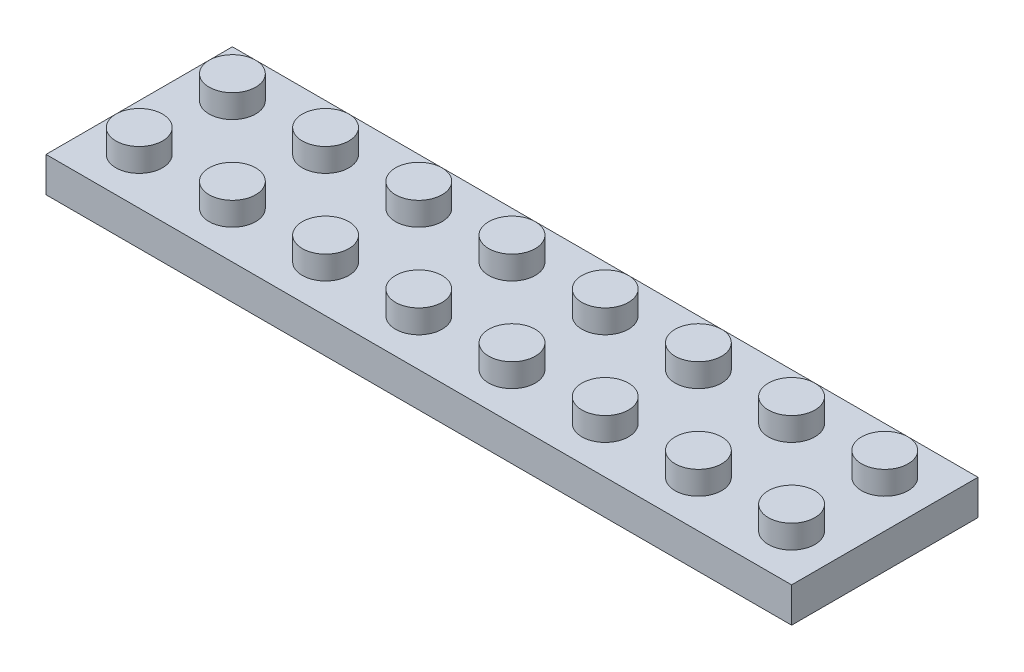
SolidWorks part; units mm, degrees
ref_plane "Front Plane" through (0, 0, 0) normal (0, 0, 1) x (1, 0, 0)
ref_plane "Top Plane" through (0, 0, 0) normal (0, 1, 0) x (1, 0, 0)
ref_plane "Right Plane" through (0, 0, 0) normal (1, 0, 0) x (0, 0, -1)
sketch "Croquis1" plane through (0, 0, 0) normal (0, 1, 0) x (1, 0, 0)
  line L1 (-32, 8) -> (32, 8)
  line L2 (-32, 8) -> (-32, -8)
  line L3 (-32, -8) -> (32, -8)
  line L4 (32, 8) -> (32, -8)
  line L5 (-32, 8) -> (32, -8) construction
  line L6 (-32, -8) -> (32, 8) construction
  point P0 (0, 0)
  dimension "D1" = 64
  dimension "D2" = 16
extrude "Saliente-Extruir1" add sketch "Croquis1" along normal blind 3
sketch "Croquis2" plane through (0, 3, 0) normal (0, 1, 0) x (1, 0, 0)
  line L0 (32, 8) -> (-32, 8) construction
  line L1 (-32, 8) -> (-32, -8) construction
  circle A0 centre (-28, 4) radius 2
  circle A1 centre (-20, 4) radius 2
  circle A2 centre (-12, 4) radius 2
  circle A3 centre (-4, 4) radius 2
  circle A4 centre (4, 4) radius 2
  circle A5 centre (12, 4) radius 2
  circle A6 centre (20, 4) radius 2
  circle A7 centre (28, 4) radius 2
  circle A8 centre (-20, -4) radius 2
  circle A9 centre (-12, -4) radius 2
  circle A10 centre (-4, -4) radius 2
  circle A11 centre (4, -4) radius 2
  circle A12 centre (12, -4) radius 2
  circle A13 centre (20, -4) radius 2
  circle A14 centre (28, -4) radius 2
  circle A15 centre (-28, -4) radius 2
  dimension "D1" = 4
  dimension "D2" = 4
  dimension "D3" = 4
  dimension "D4" = 8
  dimension "D5" = 2
extrude "Saliente-Extruir2" add sketch "Croquis2" along normal blind 2
shell "Vaciado1" thickness 1
sketch "Croquis3" plane through (0, 2, 0) normal (0, -1, 0) x (1, 0, 0)
  line L0 (-32, -8) -> (-32, 8) construction
  line L3 (32, -8) -> (-32, -8) construction
  circle A0 centre (-24, 0) radius 2.8
  circle A1 centre (-24, 0) radius 1.8
  dimension "D1" = 5.6
  dimension "D2" = 8
  dimension "D3" = 8
  dimension "D4" = 1
extrude "Saliente-Extruir3" add sketch "Croquis3" along normal blind 2
pattern_linear "MatrizL1" count 7 spacing 8 along (1, 0, 0) of "Saliente-Extruir3"
